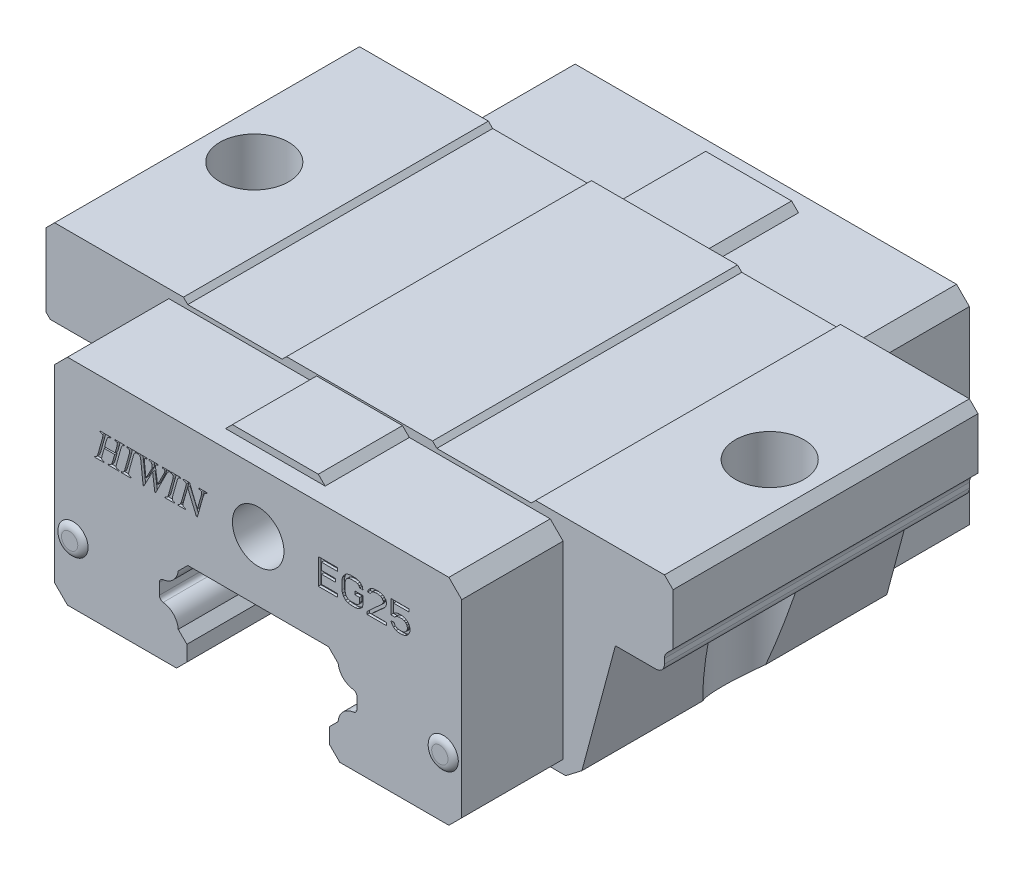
SolidWorks part; units mm, degrees
ref_plane "前视基准面" through (0, 0, 0) normal (0, 0, 1) x (1, 0, 0)
ref_plane "上视基准面" through (0, 0, 0) normal (0, 1, 0) x (1, 0, 0)
ref_plane "右视基准面" through (0, 0, 0) normal (1, 0, 0) x (0, 0, -1)
imported_body "输入1"
sketch "草图1" plane through (0, 0, 11.8) normal (0, 0, 1) x (1, 0, 0)
  line L1 (-14, 3.3) -> (14, 3.3)
  line L2 (-14, 3.3) -> (-14, -11)
  line L3 (-14, -11) -> (14, -11)
  line L4 (14, 3.3) -> (14, -11)
  line L5 (14, -6) -> (14, -2) construction
  line L6 (11, 3.3) -> (-11, 3.3) construction
  line L7 (-14, -2) -> (-14, -6) construction
  line L8 (22.2, -11) -> (10.2071, -11) construction
extrude "凸台-拉伸1" add sketch "草图1" against normal up to surface (59.1 mm away)
sketch "草图2" plane through (0, 0, 11.8) normal (0, 0, 1) x (1, 0, 0)
  line L0 (0, 0) -> (0, -18) construction
  line L1 (-35.5, 15) -> (-20.5, 15) construction
  line L23 (-11.5, -16.8) -> (-10.3, -18)
  line L24 (8.196, 0) -> (-8.196, 0)
  line L25 (10.3, -18) -> (11.5, -16.8)
  line L26 (-3, -18) -> (-2.5, -17.5)
  line L27 (8.3, -9.8) -> (8.3, -8)
  line L28 (-2.5, -17.5) -> (2.5, -17.5)
  line L29 (-3, -18) -> (3, -18) construction
  line L30 (11.5, -4.654) -> (11.5, -3.3646)
  line L31 (-8.3, -8) -> (-8.3, -9.8)
  line L32 (11.5, -13) -> (8.3, -9.8)
  line L33 (-9.305, -6.995) -> (-8.3, -8)
  line L34 (-11.5, -13) -> (-11.5, -16.8)
  line L35 (8.3, -8) -> (9.305, -6.995)
  line L36 (-8.196, 0) -> (-9.3139, -1.1179)
  line L37 (-8.3, -9.8) -> (-11.5, -13)
  line L38 (-10.3, -18) -> (-3, -18)
  line L39 (-11.5, -3.3646) -> (-11.5, -4.654)
  line L40 (9.3139, -1.1179) -> (8.196, 0)
  line L41 (3, -18) -> (10.3, -18)
  line L42 (11.5, -16.8) -> (11.5, -13)
  line L43 (2.5, -17.5) -> (3, -18)
  arc A8 (9.3139, -1.1179) -> (11.06, -2.8682) centre (11.3, -0.8827) ccw
  arc A9 (-9.305, -6.995) -> (-11.06, -5.1504) centre (-11.3, -7.136) ccw
  arc A10 (11.06, -5.1504) -> (11.5, -4.654) centre (11, -4.654) ccw
  arc A11 (11.06, -5.1504) -> (9.305, -6.995) centre (11.3, -7.136) ccw
  arc A12 (11.5, -3.3646) -> (11.06, -2.8682) centre (11, -3.3646) ccw
  arc A13 (-11.06, -2.8682) -> (-9.3139, -1.1179) centre (-11.3, -0.8827) ccw
  arc A14 (-11.06, -2.8682) -> (-11.5, -3.3646) centre (-11, -3.3646) ccw
  arc A15 (-11.5, -4.654) -> (-11.06, -5.1504) centre (-11, -4.654) ccw
  dimension "D1" = 33
extrude "切除-拉伸1" cut sketch "草图2" against normal through all
